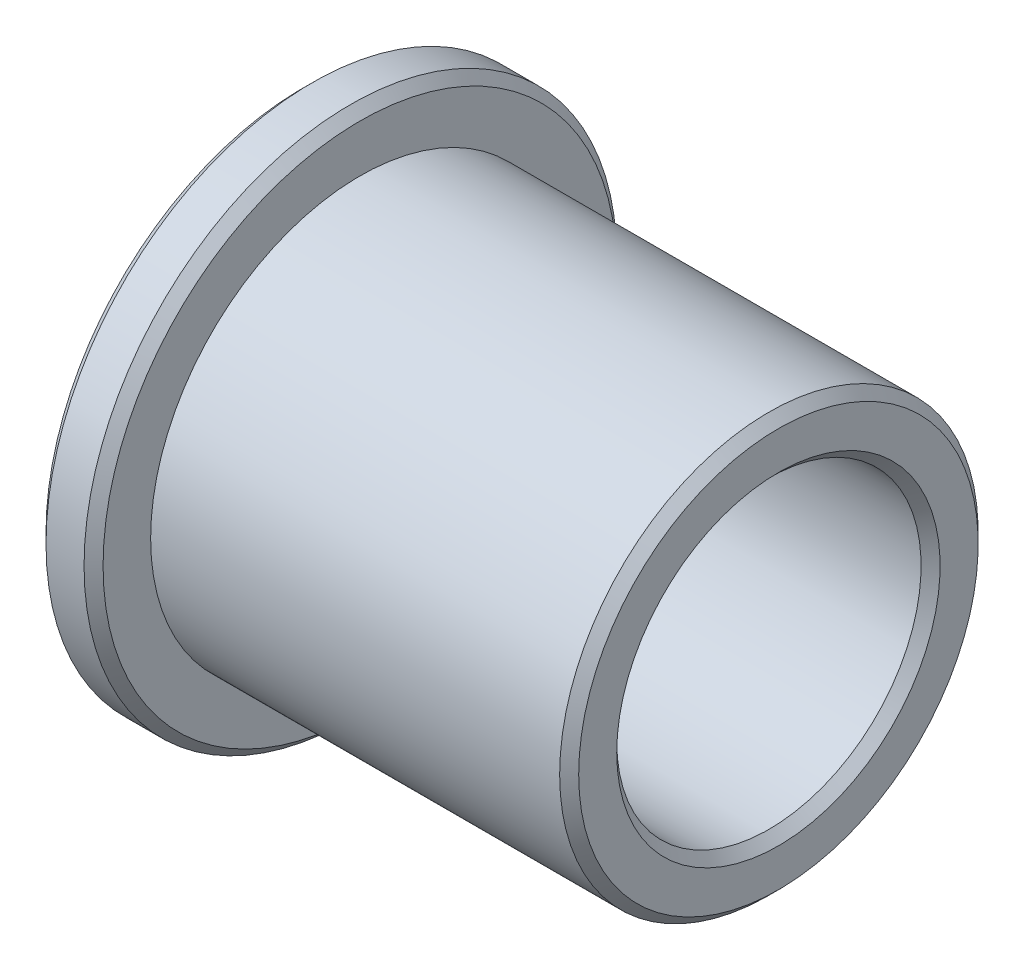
SolidWorks part; units mm, degrees
ref_plane "Face" through (0, 0, 0) normal (0, 0, 1) x (1, 0, 0)
ref_plane "Dessus" through (0, 0, 0) normal (0, 1, 0) x (1, 0, 0)
ref_plane "Droite" through (0, 0, 0) normal (1, 0, 0) x (0, 0, -1)
sketch "Esquisse1" plane through (0, 0, 0) normal (0, 0, 1) x (1, 0, 0)
  line L0 (-31.663, 0) -> (48.3045, 0) construction
  line L1 (0, 8.5) -> (0, 13.5)
  line L2 (0.5, 14) -> (2.5, 14)
  line L3 (3, 13.5) -> (3, 11)
  line L4 (3, 11) -> (24.5, 11)
  line L5 (25, 10.5) -> (25, 8.5)
  line L6 (24.5, 8) -> (0.5, 8)
  line L7 (0, 13.5) -> (0.5, 14)
  line L8 (25, 8.5) -> (24.5, 8)
  line L9 (24.5, 11) -> (25, 10.5)
  line L10 (2.5, 14) -> (3, 13.5)
  line L11 (0.5, 8) -> (0, 8.5)
  point P3 (0, 8)
  point P4 (0, 14)
  point P5 (3, 14)
  point P7 (25, 11)
  point P8 (0, 8)
  point P9 (25, 8)
  point P11 (25, 11)
  point P12 (25, 8)
  point P19 (0, 14)
  dimension "D1" = 16
  dimension "D2" = 22
  dimension "D3" = 28
  dimension "D4" = 3
  dimension "D5" = 25
  dimension "D13" = 0.5
  dimension "D14" = 0.5
  dimension "D15" = 0.5
  dimension "D16" = 0.5
revolve "Base-Révolution" add sketch "Esquisse1" angle 360 about L0
